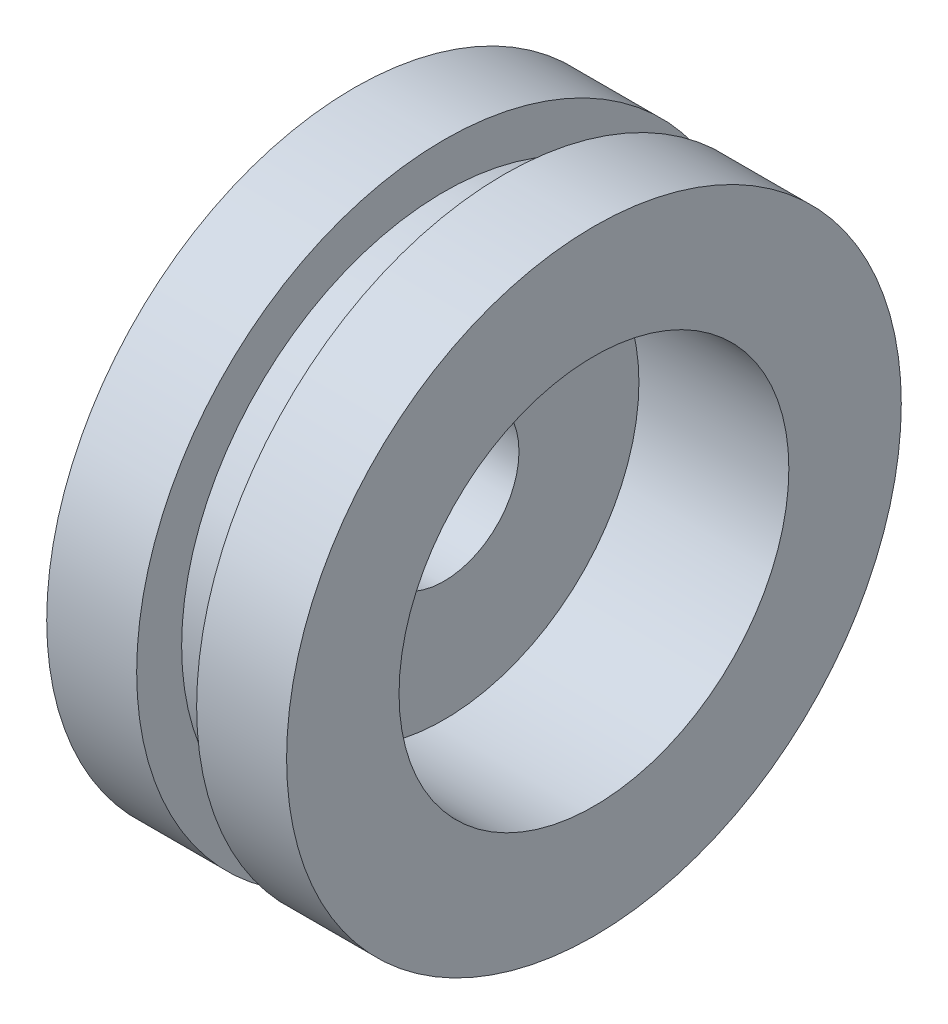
SolidWorks part; units mm, degrees
ref_plane "Plane1" through (0, 0, 0) normal (0, 0, 1) x (1, 0, 0)
ref_plane "Plane2" through (0, 0, 0) normal (0, 1, 0) x (1, 0, 0)
ref_plane "Plane3" through (0, 0, 0) normal (1, 0, 0) x (0, 0, -1)
sketch "Esquisse1" plane through (0, 0, 0) normal (1, 0, 0) x (0, 0, -1)
  circle A0 centre (0, 0) radius 20.5
  dimension "D1" = 41
extrude "Base-Extrusion" add sketch "Esquisse1" along normal blind 16
sketch "Esquisse2" plane through (16, 0, 0) normal (1, 0, 0) x (0, 0, -1)
  circle A0 centre (0, 0) radius 13
  dimension "D1" = 26
extrude "Enlèv. mat.-Extru.1" cut sketch "Esquisse2" against normal blind 10
sketch "Esquisse3" plane through (6, 0, 0) normal (1, 0, 0) x (0, 0, -1)
  circle A0 centre (0, 0) radius 5
  dimension "D1" = 10
extrude "Enlèv. mat.-Extru.2" cut sketch "Esquisse3" against normal through all
sketch "Esquisse4" plane through (0, 0, 0) normal (0, 0, 1) x (1, 0, 0)
  line L0 (10, 30) -> (10, 17.5)
  line L1 (10, 17.5) -> (6, 17.5)
  line L2 (6, 17.5) -> (6, 30)
  line L3 (10, 30) -> (6, 30)
  line L4 (16, 20.5) -> (16, -20.5) construction
  line L5 (16, 20.5) -> (0, 20.5) construction
  line L6 (-8.2424, 0) -> (26.3286, 0) construction
  line L7 (66, 0) -> (-34, 0) construction
  dimension "D1" = 6
  dimension "D2" = 10
  dimension "D3" = 3
revolve "Enlever de la matière-Pivoter1" cut sketch "Esquisse4" angle 360 about L6
